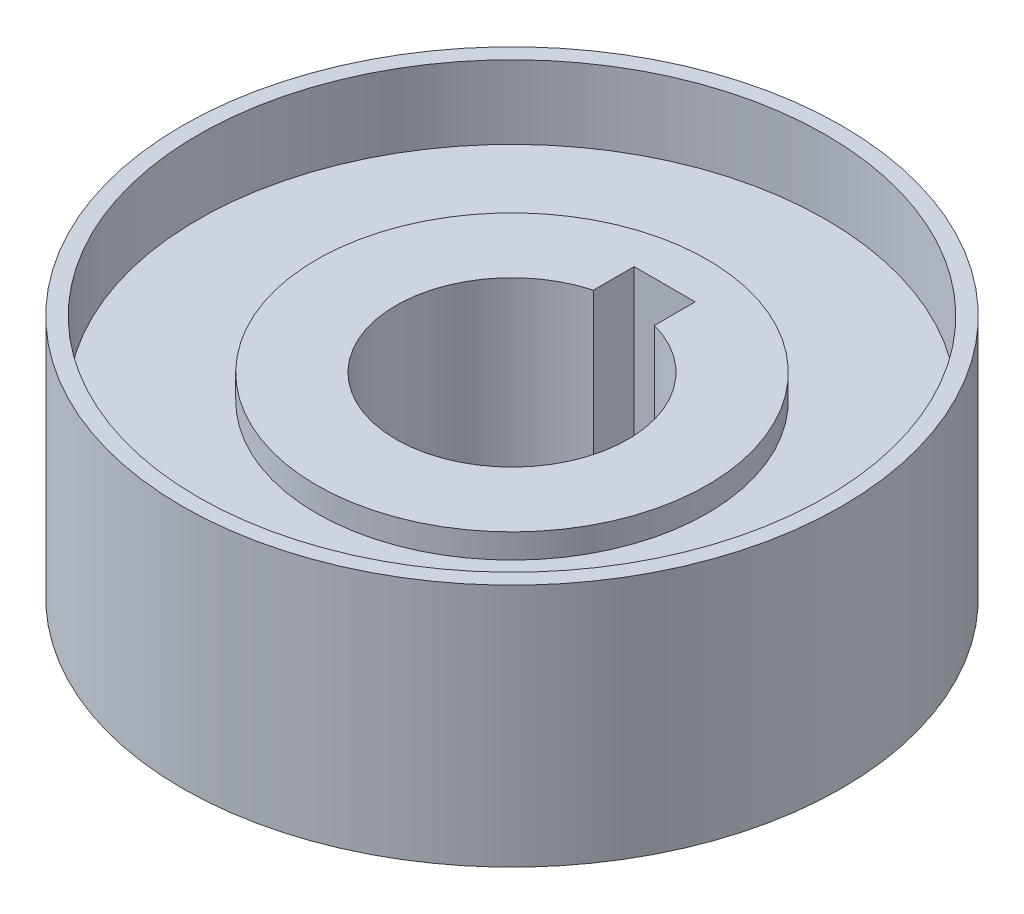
SolidWorks part; units mm, degrees
ref_plane "Front Plane" through (0, 0, 0) normal (0, 0, 1) x (1, 0, 0)
ref_plane "Top Plane" through (0, 0, 0) normal (0, 1, 0) x (1, 0, 0)
ref_plane "Right Plane" through (0, 0, 0) normal (1, 0, 0) x (0, 0, -1)
sketch "Sketch1" plane through (0, 0, 0) normal (0, 1, 0) x (1, 0, 0)
  circle A0 centre (0, 0) radius 13.5
  dimension "D1" = 27
extrude "Extrude1" add sketch "Sketch1" along normal blind 10
sketch "Sketch2" plane through (0, 10, 0) normal (0, 1, 0) x (1, 0, 0)
  circle A0 centre (0, 0) radius 8
  circle A1 centre (0, 0) radius 12.85
  dimension "D1" = 16
  dimension "D2" = 25.7
extrude "Extrude2" cut sketch "Sketch2" against normal blind 3
sketch "Sketch4" plane through (0, 10, 0) normal (0, 1, 0) x (1, 0, 0)
  circle A0 centre (0, 0) radius 8
extrude "Extrude3" cut sketch "Sketch4" against normal blind 2
sketch "Sketch5" plane through (0, 8, 0) normal (0, 1, 0) x (1, 0, 0)
  line L2 (-1.25, 4.5826) -> (-1.25, 6.25)
  line L3 (-1.25, 6.25) -> (1.25, 6.25)
  line L4 (1.25, 4.5826) -> (1.25, 6.25)
  arc A0 (-1.25, 4.5826) -> (1.25, 4.5826) centre (0, 0) ccw
  dimension "D1" = 9.5
  dimension "D2" = 2.5
extrude "Extrude4" cut sketch "Sketch5" against normal through all
